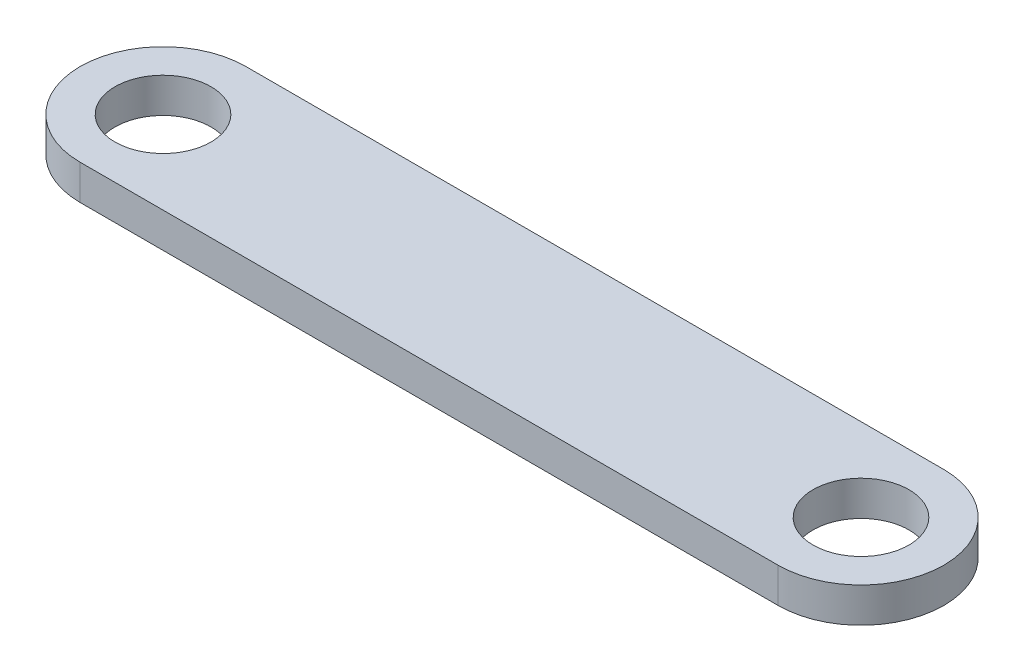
SolidWorks part; units mm, degrees
ref_plane "Front Plane" through (0, 0, 0) normal (0, 0, 1) x (1, 0, 0)
ref_plane "Top Plane" through (0, 0, 0) normal (0, 1, 0) x (1, 0, 0)
ref_plane "Right Plane" through (0, 0, 0) normal (1, 0, 0) x (0, 0, -1)
sketch "Sketch1" plane through (0, 0, 0) normal (0, 1, 0) x (1, 0, 0)
  line L1 (-20, 4.75) -> (20, 4.75)
  line L3 (-20, -4.75) -> (20, -4.75)
  arc A0 (-20, 4.75) -> (-20, -4.75) centre (-20, 0) ccw
  arc A1 (20, -4.75) -> (20, 4.75) centre (20, 0) ccw
  circle A2 centre (-20, 0) radius 2.75
  circle A3 centre (20, 0) radius 2.75
extrude "Boss-Extrude1" add sketch "Sketch1" along normal blind 2
equation "\"D4@Sketch1\"=\"D3@Sketch1\"/2"
equation "\"D6@Sketch1\"=\"D5@Sketch1\""
equation "\"D7@Sketch1\"=\"D2@Sketch1\""
